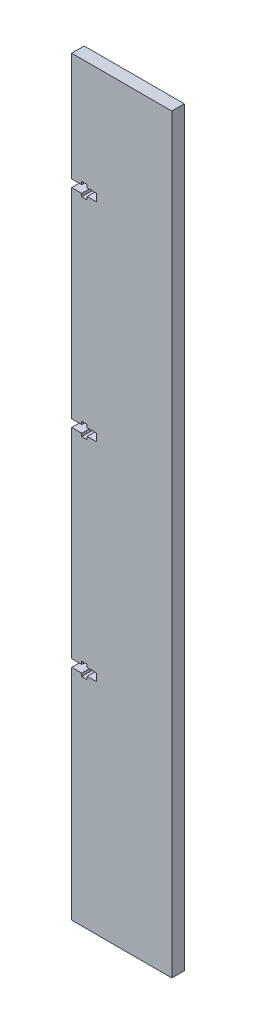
SolidWorks part; units mm, degrees
ref_plane "Front" through (0, 0, 0) normal (0, 0, 1) x (1, 0, 0)
ref_plane "Top" through (0, 0, 0) normal (0, 1, 0) x (1, 0, 0)
ref_plane "Right" through (0, 0, 0) normal (1, 0, 0) x (0, 0, -1)
sketch "Sketch1" plane through (0, 0, 0) normal (0, 0, 1) x (1, 0, 0)
  line L1 (-20, 150) -> (20, 150)
  line L2 (-20, 150) -> (-20, -150)
  line L3 (-20, -150) -> (20, -150)
  line L4 (20, 150) -> (20, -150)
  line L5 (-20, 150) -> (20, -150) construction
  line L6 (-20, -150) -> (20, 150) construction
  point P0 (0, 0)
  dimension "D1" = 300
  dimension "D2" = 40
extrude "Boss-Extrude1" add sketch "Sketch1" along normal blind 5
sketch "Sketch2" plane through (0, 0, 0) normal (0, 0, -1) x (-1, 0, 0)
  line L0 (10, -61) -> (7.6703, -61)
  line L1 (20, 150) -> (20, -150) construction
  line L3 (20, 105) -> (20.423, 105)
  line L4 (20, -59.5) -> (16, -59.5)
  line L5 (16, -59.5) -> (16, -58.35)
  line L6 (16, -58.35) -> (13.8, -58.35)
  line L7 (13.8, -58.35) -> (13.8, -59.5)
  line L8 (13.8, -59.5) -> (10, -59.5)
  line L9 (10, -59.5) -> (10, -62.5)
  line L10 (10, -62.5) -> (13.8, -62.5)
  line L11 (13.8, -62.5) -> (13.8, -63.65)
  line L12 (13.8, -63.65) -> (16, -63.65)
  line L13 (16, -63.65) -> (16, -62.5)
  line L14 (16, -62.5) -> (20, -62.5)
  line L15 (20, -62.5) -> (20, -59.5)
  line L17 (20, 23.5) -> (16, 23.5)
  line L18 (16, 23.5) -> (16, 24.65)
  line L19 (16, 24.65) -> (13.8, 24.65)
  line L20 (13.8, 24.65) -> (13.8, 23.5)
  line L21 (13.8, 23.5) -> (10, 23.5)
  line L22 (10, 23.5) -> (10, 20.5)
  line L23 (10, 20.5) -> (13.8, 20.5)
  line L24 (13.8, 20.5) -> (13.8, 19.35)
  line L25 (13.8, 19.35) -> (16, 19.35)
  line L26 (16, 19.35) -> (16, 20.5)
  line L27 (16, 20.5) -> (20, 20.5)
  line L28 (20, 20.5) -> (20, 23.5)
  line L30 (20, 106.5) -> (16, 106.5)
  line L31 (16, 106.5) -> (16, 107.65)
  line L32 (16, 107.65) -> (13.8, 107.65)
  line L33 (13.8, 107.65) -> (13.8, 106.5)
  line L34 (13.8, 106.5) -> (10, 106.5)
  line L35 (10, 106.5) -> (10, 103.5)
  line L36 (10, 103.5) -> (13.8, 103.5)
  line L37 (13.8, 103.5) -> (13.8, 102.35)
  line L38 (13.8, 102.35) -> (16, 102.35)
  line L39 (16, 102.35) -> (16, 103.5)
  line L40 (16, 103.5) -> (20, 103.5)
  line L41 (20, 103.5) -> (20, 106.5)
  point P0 (18, 103.5)
  point P4 (20, -59)
  point P5 (20, 105)
  point P6 (20, 7)
  point P14 (20, -61)
  point P16 (20, -61)
  point P17 (20, -61)
  point P18 (20, -61)
  point P19 (20, -61)
  point P20 (20, -61)
  point P21 (20, -61)
  point P22 (20, -61)
  point P35 (20, -61)
  point P38 (20, 0)
  point P39 (20, 22)
  point P40 (20, 22)
  point P41 (20, 22)
  point P42 (20, 22)
  point P43 (20, 22)
  point P44 (20, 22)
  point P45 (20, 22)
  point P46 (20, 22)
  point P59 (20, 22)
  point P62 (20, 105)
  point P63 (20, 105)
  point P64 (20, 105)
  point P65 (20, 105)
  point P66 (20, 105)
  point P67 (20, 105)
  point P68 (20, 105)
  point P69 (20, 105)
  point P70 (20, 105)
  point P83 (20, 105)
  dimension "D1" = 45
  dimension "D2" = 4
  dimension "D3" = 80
  dimension "D4" = 2.2
  dimension "D5" = 5.3
  dimension "D6" = 10
  dimension "D7" = 4
  dimension "D8" = 2.2
  dimension "D9" = 5.3
  dimension "D10" = 10
  dimension "D11" = 4
  dimension "D12" = 2.2
  dimension "D13" = 5.3
  dimension "D14" = 10
  dimension "D15" = 80
extrude "Cut-Extrude1" cut sketch "Sketch2" against normal blind 10 contours L13 L14 L4 L5 L6 L7 L8 L9 L10 L11 L12 M3 | L26 L27 L17 L18 L19 L20 L21 L22 L23 L24 L25 M3 | L39 L40 L30 L31 L32 L33 L34 L35 L36 L37 L38 M3
sketch "Sketch3" plane through (0, 0, 0) normal (0, 0, -1) x (-1, 0, 0)
  line L0 (13.8, 106.5) -> (13.8, 107.65)
  line L1 (-20, -150) -> (20, -150)
  line L2 (-20, -150) -> (-20, 150)
  line L3 (-20, 150) -> (20, 150)
  line L4 (20, -150) -> (20, -62.5)
  line L5 (10, -62.5) -> (13.8, -62.5)
  line L6 (10, -62.5) -> (10, -59.5)
  line L7 (10, -59.5) -> (13.8, -59.5)
  line L9 (13.8, -63.65) -> (16, -63.65)
  line L10 (13.8, -63.65) -> (13.8, -62.5)
  line L11 (13.8, -58.35) -> (16, -58.35)
  line L12 (16, -63.65) -> (16, -62.5)
  line L13 (10, 20.5) -> (13.8, 20.5)
  line L14 (10, 20.5) -> (10, 23.5)
  line L15 (10, 23.5) -> (13.8, 23.5)
  line L16 (20, -59.5) -> (20, 20.5)
  line L17 (13.8, 19.35) -> (16, 19.35)
  line L18 (13.8, 19.35) -> (13.8, 20.5)
  line L19 (13.8, 24.65) -> (16, 24.65)
  line L20 (16, 19.35) -> (16, 20.5)
  line L21 (10, 103.5) -> (13.8, 103.5)
  line L22 (10, 103.5) -> (10, 106.5)
  line L23 (10, 106.5) -> (13.8, 106.5)
  line L24 (20, 23.5) -> (20, 103.5)
  line L25 (13.8, 102.35) -> (16, 102.35)
  line L26 (13.8, 102.35) -> (13.8, 103.5)
  line L27 (13.8, 107.65) -> (16, 107.65)
  line L28 (16, 102.35) -> (16, 103.5)
  line L29 (16, 103.5) -> (20, 103.5)
  line L30 (16, 106.5) -> (20, 106.5)
  line L31 (16, 106.5) -> (16, 107.65)
  line L32 (20, 106.5) -> (20, 150)
  line L33 (13.8, 23.5) -> (13.8, 24.65)
  line L34 (16, 20.5) -> (20, 20.5)
  line L35 (16, 23.5) -> (20, 23.5)
  line L36 (16, 23.5) -> (16, 24.65)
  line L37 (13.8, -59.5) -> (13.8, -58.35)
  line L38 (16, -62.5) -> (20, -62.5)
  line L39 (16, -59.5) -> (20, -59.5)
  line L40 (16, -59.5) -> (16, -58.35)
